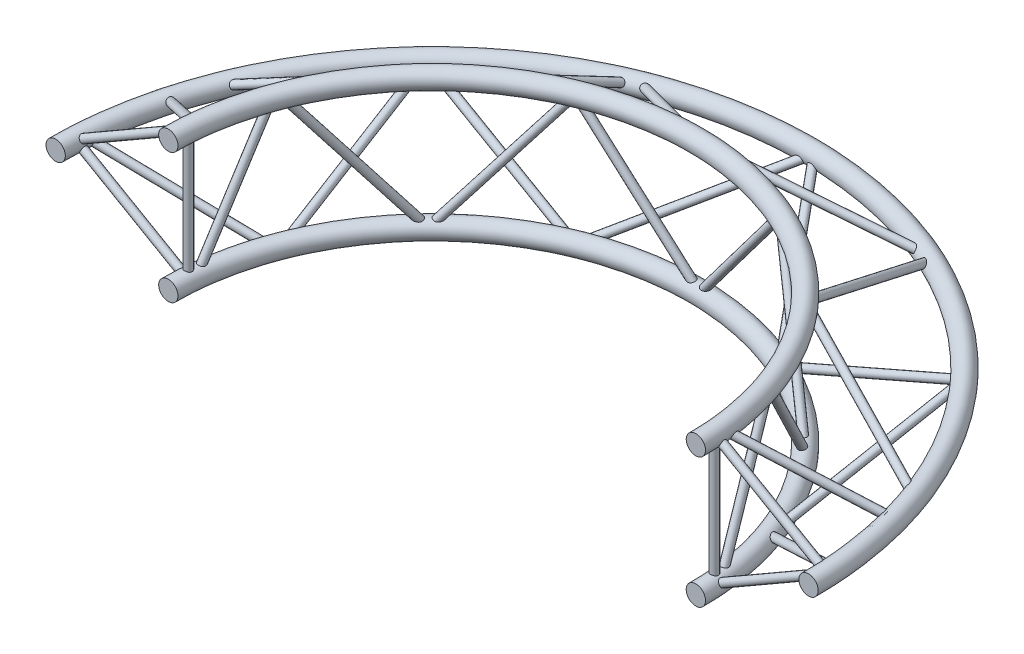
SolidWorks part; units mm, degrees
ref_plane "Face" through (0, 0, 0) normal (0, 0, 1) x (1, 0, 0)
ref_plane "Dessus" through (0, 0, 0) normal (0, 1, 0) x (1, 0, 0)
ref_plane "Droite" through (0, 0, 0) normal (1, 0, 0) x (0, 0, -1)
sketch "Esquisse1" plane through (0, 0, 0) normal (0, 0, 1) x (1, 0, 0)
  line L0 (683.1494, 168.5) -> (683.1494, -168.5) construction
  line L1 (683.1494, -168.5) -> (975, 0) construction
  line L2 (975, 0) -> (683.1494, 168.5) construction
  line L3 (780.433, 61.5908) -> (780.433, -61.5908) construction
  line L4 (72.9361, 0) -> (1487.9298, 0) construction
  line L5 (780.433, 0) -> (683.1494, 168.5)
  line L8 (1000, 0) -> (1000, 276.3926) construction
  line L9 (0, 252.4415) -> (0, -235.2114) construction
  circle A0 centre (780.433, 0) radius 194.567 construction
  circle A1 centre (683.1494, 168.5) radius 25
  circle A2 centre (683.1494, -168.5) radius 25
  circle A3 centre (975, 0) radius 25
  dimension "D1" = 120
  dimension "D2" = 50
  dimension "D3" = 337
  dimension "D4" = 1000
revolve "Révolution1" add sketch "Esquisse1" angle 180 about L9
ref_point "Point1"
ref_plane "Plan1" through (0, -168.5, 0) normal (0, 1, 0) x (-1, 0, 0)
sketch "cercle1" plane through (0, -168.5, 0) normal (0, 1, 0) x (-1, 0, 0)
  circle A0 centre (0, 0) radius 683.1494
ref_point "Point2"
ref_plane "Plan2" through (0, 0, 0) normal (0, 1, 0) x (-1, 0, 0)
sketch "cercle2" plane through (0, 0, 0) normal (0, 1, 0) x (-1, 0, 0)
  circle A0 centre (0, 0) radius 975
ref_point "Point3"
ref_plane "Plan3" through (0, 168.5, 0) normal (0, 1, 0) x (-1, 0, 0)
sketch "cercle3" plane through (0, 168.5, 0) normal (0, 1, 0) x (-1, 0, 0)
  circle A0 centre (0, 0) radius 683.1494
ref_point "Point4"
ref_plane "Plan4" through (0, 0, 0) normal (0, 1, 0) x (-1, 0, 0)
sketch "cercle4" plane through (0, 0, 0) normal (0, 1, 0) x (-1, 0, 0)
  circle A0 centre (0, 0) radius 780.433
ref_plane "plan_sym" through (0, 0, 0) normal (1, 0, 0) x (0, 0, -1)
sketch3d "Esquisse3D1"
  line L0 (681.3197, 168.5, -49.9665) -> (681.3178, -168.5, -49.9916)
  line L1 (681.3178, -168.5, -49.9916) -> (973.7179, 0, -49.9836)
  line L2 (973.7179, 0, -49.9836) -> (681.3197, 168.5, -49.9665)
  line L3 (683.1494, -168.5, 0) -> (975, 0, 0) construction
  circle A0 centre (0, 168.5, 0) radius 683.1494 construction
  circle A1 centre (0, -168.5, 0) radius 683.1494 construction
  circle A2 centre (0, 0, 0) radius 975 construction
  circle A3 centre (683.1494, 168.5, 0) radius 25 construction
  point P4 (0, 851.6494, 0)
  point P7 (0, 514.6494, 0)
  point P11 (0, 975, 0)
  point P14 (683.1494, 168.5, 25)
  dimension "D1" = 50
  dimension "D2" = 50
  dimension "D3" = 50
ref_plane "Plan6" through (681.3178, -168.5, -49.9916) normal (0, -1, -0.0001) x (1, 0, 0)
sketch "Esquisse8" plane through (681.3178, -168.5, -49.9916) normal (0, -1, -0.0001) x (1, 0, 0)
  circle A0 centre (0, 0) radius 10
  dimension "D1" = 20
sweep "treilli droit départ" add profiles "Esquisse8" path "Esquisse3D1"
mirror "treilli droit fin" about plane through (0, 0, 0) normal (1, 0, 0) of "treilli droit départ"
sketch3d "Esquisse3D2"
  line L0 (972.4872, 0, -69.9549) -> (643.2911, -168.5, -229.9343)
  line L1 (683.1494, -168.5, 0) -> (975, 0, 0) construction
  circle A0 centre (0, 0, 0) radius 975 construction
  circle A1 centre (0, -168.5, 0) radius 683.1494 construction
  point P4 (0, 975, 0)
  point P7 (0, 514.6494, 0)
  dimension "D1" = 70
  dimension "D2" = 230.7963
ref_plane "Plan7" through (643.2911, -168.5, -229.9343) normal (-0.817, -0.4182, -0.397) x (-0.4238, -0.0314, 0.9052)
sketch "Esquisse9" plane through (643.2911, -168.5, -229.9343) normal (-0.817, -0.4182, -0.397) x (-0.4238, -0.0314, 0.9052)
  circle A0 centre (0, 0) radius 10
  dimension "D1" = 20
sweep "treilli depart 1" add profiles "Esquisse9" path "Esquisse3D2"
sketch3d "Esquisse3D3"
  line L0 (679.5631, -168.5, -69.9081) -> (644.1631, 168.5, -227.4797)
  circle A0 centre (0, -168.5, 0) radius 683.1494 construction
  circle A1 centre (0, 168.5, 0) radius 683.1494 construction
  point P4 (0, 514.6494, 0)
  point P7 (0, 851.6494, 0)
  dimension "D1" = 70
  dimension "D2" = 230.7963
ref_plane "Plan8" through (679.5631, -168.5, -69.9081) normal (-0.0947, 0.9018, -0.4217) x (-0.9942, -0.107, -0.0055)
sketch "Esquisse10" plane through (679.5631, -168.5, -69.9081) normal (-0.0947, 0.9018, -0.4217) x (-0.9942, -0.107, -0.0055)
  circle A0 centre (0, 0) radius 10
  dimension "D1" = 20
sweep "treilli depart 2" add profiles "Esquisse10" path "Esquisse3D3"
sketch3d "Esquisse3D4"
  line L0 (679.5631, 168.5, -69.9081) -> (940.1207, 0, -258.4534)
  circle A0 centre (0, 168.5, 0) radius 683.1494 construction
  circle A1 centre (0, 0, 0) radius 975 construction
  point P4 (0, 851.6494, 0)
  point P7 (0, 975, 0)
  dimension "D1" = 260.7963
  dimension "D2" = 70
ref_plane "Plan9" through (940.1207, 0, -258.4534) normal (0.7176, -0.4641, -0.5193) x (0.6868, 0.5951, 0.4173)
sketch "Esquisse11" plane through (940.1207, 0, -258.4534) normal (0.7176, -0.4641, -0.5193) x (0.6868, 0.5951, 0.4173)
  circle A0 centre (0, 0) radius 10
  dimension "D1" = 20
sweep "treilli depart 3" add profiles "Esquisse11" path "Esquisse3D4"
mirror "treillis fin" about plane through (0, 0, 0) normal (1, 0, 0) of "treilli depart 1", "treilli depart 2", "treilli depart 3"
sketch3d "Esquisse3D6"
  line L0 (644.1631, 168.5, -227.4797) -> (502.2353, -168.5, -463.0906)
  line L1 (647.1694, 139.8813, -214.0984) -> (677.3586, -147.5136, -79.7207) construction
  circle A0 centre (0, 168.5, 0) radius 683.1494 construction
  circle A1 centre (0, -168.5, 0) radius 683.1494 construction
  point P4 (0, 851.6494, 0)
  point P7 (0, 514.6494, 0)
  dimension "D1" = 435
ref_plane "Plan11" through (502.2353, -168.5, -463.0906) normal (-0.3263, -0.7747, -0.5416) x (0.9441, -0.2382, -0.2281)
sketch "Esquisse12" plane through (502.2353, -168.5, -463.0906) normal (-0.3263, -0.7747, -0.5416) x (0.9441, -0.2382, -0.2281)
  circle A0 centre (0, 0) radius 10
  dimension "D1" = 20
sweep "treilli int 1" add profiles "Esquisse12" path "Esquisse3D6"
ref_plane "Plan10" through (0, 0, 0) normal (0.6779, 0, 0.7352) x (0.7352, 0, -0.6779)
sketch3d "Esquisse3D7"
  line L2 (915.9819, 0, -334.0692) -> (502.2353, 168.5, -463.0906)
  circle A0 centre (0, 168.5, 0) radius 683.1494 construction
  circle A1 centre (0, 0, 0) radius 975 construction
  point P4 (0, 851.6494, 0)
  point P5 (0, 975, 0)
  dimension "D1" = 465
ref_plane "Plan12" through (502.2353, 168.5, -463.0906) normal (-0.8898, 0.3624, -0.2775) x (-0.4419, -0.5321, 0.7222)
sketch "Esquisse13" plane through (502.2353, 168.5, -463.0906) normal (-0.8898, 0.3624, -0.2775) x (-0.4419, -0.5321, 0.7222)
  circle A0 centre (0, 0) radius 10
  dimension "D1" = 20
sweep "treilli int 2" add profiles "Esquisse13" path "Esquisse3D7"
sketch3d "Esquisse3D9"
  line L0 (643.2911, -168.5, -229.9343) -> (716.7969, 0, -660.929)
  line L1 (953.7236, -9.6042, -79.0734) -> (673.274, -153.1531, -215.3635) construction
  circle A0 centre (0, -168.5, 0) radius 683.1494 construction
  circle A1 centre (0, 0, 0) radius 975 construction
  point P4 (0, 514.6494, 0)
  point P7 (0, 975, 0)
  dimension "D1" = 468.5636
ref_plane "Plan13" through (643.2911, -168.5, -229.9343) normal (0.1569, 0.3596, -0.9198) x (-0.9846, 0.1301, -0.1171)
sketch "Esquisse14" plane through (643.2911, -168.5, -229.9343) normal (0.1569, 0.3596, -0.9198) x (-0.9846, 0.1301, -0.1171)
  circle A0 centre (0, 0) radius 10
  dimension "D1" = 20
sweep "treilli int 3" add profiles "Esquisse14" path "Esquisse3D9"
sketch3d "Esquisse3D10"
  line L0 (278.8897, 168.5, -623.6295) -> (502.2353, -168.5, -463.0906)
  circle A0 centre (0, 168.5, 0) radius 683.1494 construction
  circle A1 centre (0, -168.5, 0) radius 683.1494 construction
  point P4 (0, 851.6494, 0)
  point P7 (0, 514.6494, 0)
  dimension "D1" = 435
ref_plane "Plan14" through (278.8897, 168.5, -623.6295) normal (0.5134, -0.7747, 0.3691) x (0.852, 0.409, -0.3268)
sketch "Esquisse15" plane through (278.8897, 168.5, -623.6295) normal (0.5134, -0.7747, 0.3691) x (0.852, 0.409, -0.3268)
  circle A0 centre (0, 0) radius 10
  dimension "D1" = 20
sweep "treilli int4" add profiles "Esquisse15" path "Esquisse3D10"
sketch3d "Esquisse3D11"
  line L0 (502.2353, 168.5, -463.0906) -> (407.1379, 0, -885.9253)
  circle A0 centre (0, 0, 0) radius 975 construction
  point P5 (0, 975, 0)
  dimension "D1" = 465
ref_plane "Plan15" through (407.1379, 0, -885.9253) normal (-0.2045, -0.3624, -0.9093) x (-0.8796, 0.4756, 0.0083)
sketch "Esquisse16" plane through (407.1379, 0, -885.9253) normal (-0.2045, -0.3624, -0.9093) x (-0.8796, 0.4756, 0.0083)
  circle A0 centre (0, 0) radius 10
  dimension "D1" = 20
sweep "treilli int 5" add profiles "Esquisse16" path "Esquisse3D11"
sketch3d "Esquisse3D12"
  line L0 (716.7969, 0, -660.929) -> (281.2656, -168.5, -622.5615)
  circle A0 centre (0, -168.5, 0) radius 683.1494 construction
  point P5 (0, 514.6494, 0)
  dimension "D1" = 468.5636
ref_plane "Plan16" through (716.7969, 0, -660.929) normal (-0.9295, -0.3596, 0.0819) x (0.2086, -0.3294, 0.9209)
sketch "Esquisse17" plane through (716.7969, 0, -660.929) normal (-0.9295, -0.3596, 0.0819) x (0.2086, -0.3294, 0.9209)
  circle A0 centre (0, 0) radius 10
  dimension "D1" = 20
sweep "treilli int 6" add profiles "Esquisse17" path "Esquisse3D12"
sketch "Esquisse19" plane through (0, 0, 0) normal (0, 1, 0) x (1, 0, 0)
  line L0 (502.2353, 463.0906) -> (0, 0)
  line L1 (0, 0) -> (644.1631, 227.4797)
  line L2 (647.1694, 214.0984) -> (677.3586, 79.7207) construction
  line L3 (-197.181, -181.8125) -> (197.181, 181.8125) construction
  line L4 (636.1411, 240.7969) -> (515.0782, 441.7703) construction
  circle A1 centre (0, 0) radius 683.1494 construction
  circle A2 centre (0, 0) radius 683.1494 construction
  dimension "D1" = 23.228
pattern_circular "Répétition circulaire1" count 3 every 46.455 of "treilli int 1", "treilli int 3", "treilli int 2"
pattern_circular "Répétition circulaire2" count 3 every 46.455 of "treilli int4", "treilli int 6", "treilli int 5"
sketch3d "Esquisse3D13"
  line L0 (-679.5536, 168.5, -70) -> (-642.9823, -168.5, -230.7963)
  circle A0 centre (0, 168.5, 0) radius 683.1494 construction
  circle A1 centre (0, -168.5, 0) radius 683.1494 construction
  point P4 (0, 851.6494, 0)
  point P7 (0, 514.6494, 0)
  dimension "D1" = 230.7963
  dimension "D2" = 70
ref_plane "Plan17" through (-679.5536, 168.5, -70) normal (0.0975, -0.8982, -0.4286) x (0.8044, 0.3247, -0.4975)
sketch "Esquisse21" plane through (-679.5536, 168.5, -70) normal (0.0975, -0.8982, -0.4286) x (0.8044, 0.3247, -0.4975)
  circle A0 centre (0, 0) radius 10
  dimension "D1" = 20
sweep "treilli sym 1" [suppressed] add profiles "Esquisse21" path "Esquisse3D13"
sketch3d "Esquisse3D14"
  line L0 (-631.4099, 168.5, -260.7963) -> (-972.4839, 0, -70)
  circle A0 centre (0, 168.5, 0) radius 683.1494 construction
  circle A1 centre (0, 0, 0) radius 975 construction
  point P4 (0, 851.6494, 0)
  point P7 (0, 975, 0)
  dimension "D1" = 70
  dimension "D2" = 260.7963
ref_plane "Plan18" [suppressed] through (70, 0, -1473.338) normal (-0.4669, -0.4128, -0.7821) x (-0.0115, -0.8815, 0.4721)
sketch "Esquisse22" [suppressed] plane through (70, 0, -1473.338) normal (-0.4669, -0.4128, -0.7821) x (-0.0115, -0.8815, 0.4721)
  circle A0 centre (-5.0885, 0) radius 10
  dimension "D1" = 20
sweep "treilli sym 2" [suppressed] add profiles "Esquisse22" path "Esquisse3D14"
sketch3d "Esquisse3D15"
  line L0 (-947.6836, 0, -229.1741) -> (-679.5536, -168.5, -70)
  circle A0 centre (0, 0, 0) radius 975 construction
  circle A1 centre (0, -168.5, 0) radius 683.1494 construction
  circle A3 centre (-975, 0, 0) radius 25 construction
  point P4 (0, 975, 0)
  point P7 (0, 514.6494, 0)
  point P13 (-975, 0, -25)
  dimension "D1" = 70
  dimension "D2" = 230.7963
ref_plane "Plan19" [suppressed] through (229.8917, 0, -1456.9745) normal (-0.4433, -0.4672, 0.765) x (-0.1344, -0.8091, -0.5721)
sketch "Esquisse23" [suppressed] plane through (229.8917, 0, -1456.9745) normal (-0.4433, -0.4672, 0.765) x (-0.1344, -0.8091, -0.5721)
  circle A0 centre (0, 0) radius 10
  dimension "D1" = 20
sweep "treilli sym 3" [suppressed] add profiles "Esquisse23" path "Esquisse3D15"
equation "\"D1@plan_sym\"=\"D1@Révolution1\"/2"
equation "\"pas_theorique\"=500"
equation "\"demi_pas_theorique\"=\"pas_theorique\"/2"
equation "\"nb_demi_pas_theorique\"=(2*\"D4@Esquisse1\"* pi -2*70)/(\"demi_pas_theorique\")"
equation "\"nb_arche\"=360/\"D1@Révolution1\""
equation "\"nb_demi_pas_th_2\"=\"nb_demi_pas_theorique\"/\"nb_arche\""
equation "\"nb_demi_pas_entier\"=int(\"nb_demi_pas_th_2\")-1"
equation "\"D2@Esquisse3D2\" = 70+(\"nb_demi_pas_th_2\"-\"nb_demi_pas_entier\")*\"pas_theorique\"/4"
equation "\"D2@Esquisse3D3\" = \"D2@Esquisse3D2\""
equation "\"D1@Esquisse3D4\"=\"D2@Esquisse3D2\"+30"
equation "\"D1@Esquisse3D10\" = \"D1@Esquisse3D6\""
equation "\"D1@Esquisse3D11\" = \"D1@Esquisse3D7\""
equation "\"D1@Esquisse3D12\" = \"D1@Esquisse3D9\""
equation "\"D2@Répétition circulaire1\"=\"D1@Esquisse19\"*2"
equation "\"D1@Esquisse3D13\" = \"D2@Esquisse3D2\""
equation "\"D2@Esquisse3D14\" = \"D1@Esquisse3D4\""
equation "\"D2@Esquisse3D15\" = \"D2@Esquisse3D3\""
equation "\"D2@Répétition circulaire2\" = \"D1@Esquisse19\"*2"
